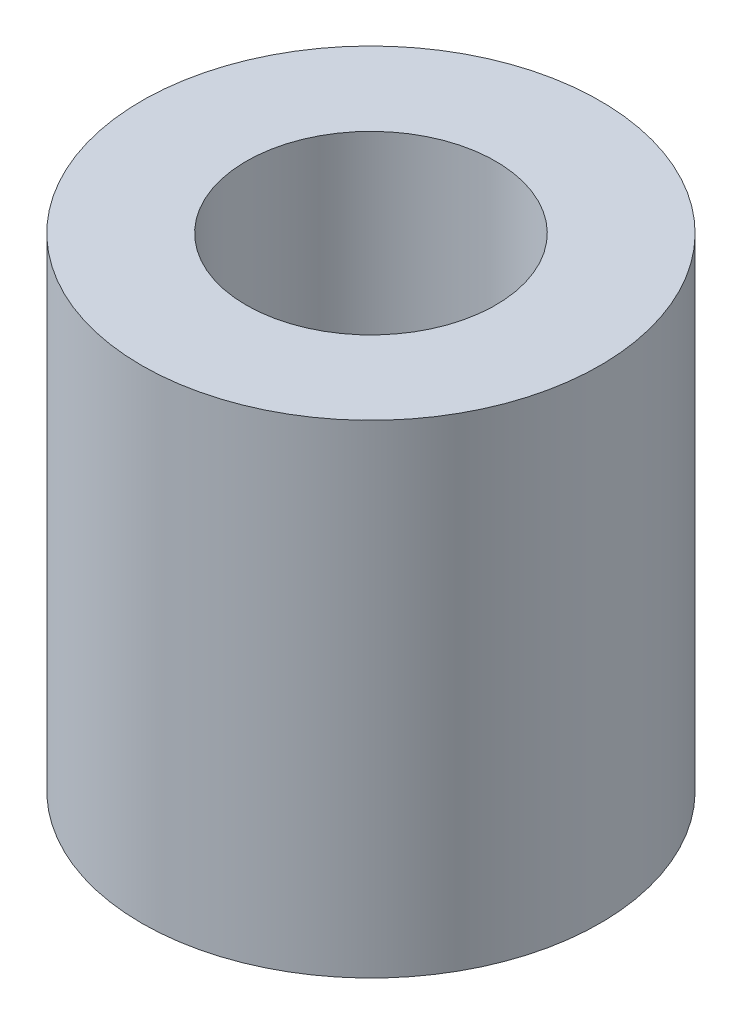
SolidWorks part; units mm, degrees
ref_plane "Front" through (0, 0, 0) normal (0, 0, 1) x (1, 0, 0)
ref_plane "Top" through (0, 0, 0) normal (0, 1, 0) x (1, 0, 0)
ref_plane "Right" through (0, 0, 0) normal (1, 0, 0) x (0, 0, -1)
sketch "Sketch1" plane through (0, 0, 0) normal (0, 1, 0) x (1, 0, 0)
  circle A0 centre (0, 0) radius 3.175
  dimension "D1" = 6.35
extrude "Extrude1" add sketch "Sketch1" against normal blind 7.1437
chamfer "Chamfer1" distance 0.4536 angle 60 1 edges at (0, -7.1437, 3.175)
hole_wizard "#8-32 Tapped Hole1" positions "Sketch3" profile "Sketch2" tap size "#8-32" standard "Ansi Inch"
sketch "Sketch3" plane through (0, 0, 0) normal (0, 1, 0) x (-1, 0, 0)
  point P0 (0, 0)
sketch "Sketch2" plane through (0, 0, 0) normal (1, 0, 0) x (0, 0, 1)
  line L0 (0, 0) -> (0, 7.1437)
  line L1 (0, 7.1437) -> (1.7272, 7.1437)
  line L2 (1.7272, 7.1437) -> (1.7272, 0)
  line L5 (1.7272, 0) -> (0, 0)
  line L11 (0, -6.35) -> (0, 107.95) construction
  dimension "Thru Tap Drill Dia." = 3.4544
  dimension "Thru Tap Drill Depth" = 7.1437
